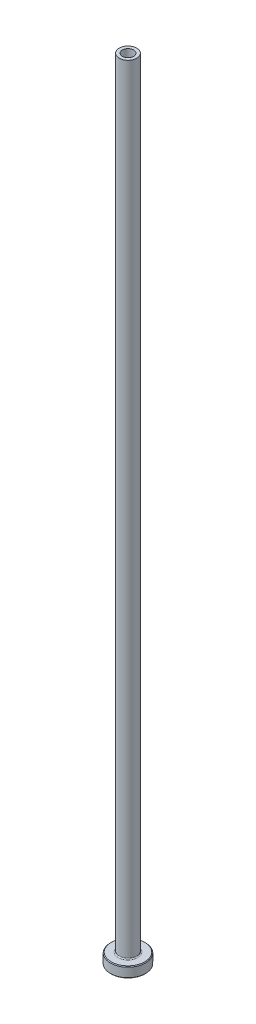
SolidWorks part; units mm, degrees
ref_plane "Front Plane" through (0, 0, 0) normal (0, 0, 1) x (1, 0, 0)
ref_plane "Top Plane" through (0, 0, 0) normal (0, 1, 0) x (1, 0, 0)
ref_plane "Right Plane" through (0, 0, 0) normal (1, 0, 0) x (0, 0, -1)
sketch "Sketch1" plane through (0, 0, 0) normal (0, 0, 1) x (1, 0, 0)
  line L0 (-1.6, 225) -> (-2.5, 225)
  line L1 (-2.5, 225) -> (-2.5, 3)
  line L2 (-2.5, 3) -> (-5, 3)
  line L3 (-5, 3) -> (-5, 0)
  line L4 (5.5, 0) -> (-5.5, 0) construction
  line L5 (-5, 0) -> (-1.85, 0)
  line L6 (-1.6, 180) -> (-1.6, 225)
  line L7 (0, 92.1877) -> (0, -15.5353) construction
  line L8 (0, -5.5) -> (0, 5.5) construction
  line L9 (-1.6, 180) -> (-1.85, 168)
  line L10 (-1.85, 168) -> (-1.85, 0)
  dimension "D1" = 0.25
  dimension "ID" = 3.2
  dimension "OD" = 5
  dimension "L" = 225
  dimension "H" = 10
  dimension "T" = 3
  dimension "N" = 45
  dimension "D2" = 12
revolve "Revolve1" add sketch "Sketch1" angle 360 about L7
fillet "Fillet1" radius 0.3 1 edges at (0, 3, 2.5)
chamfer "Chamfer1" distance 0.2 angle 45 2 edges at (0, 3, 5) (0, 0, 5)
chamfer "Chamfer3" distance 0.5 angle 45 1 edges at (0, 0, 1.85)
